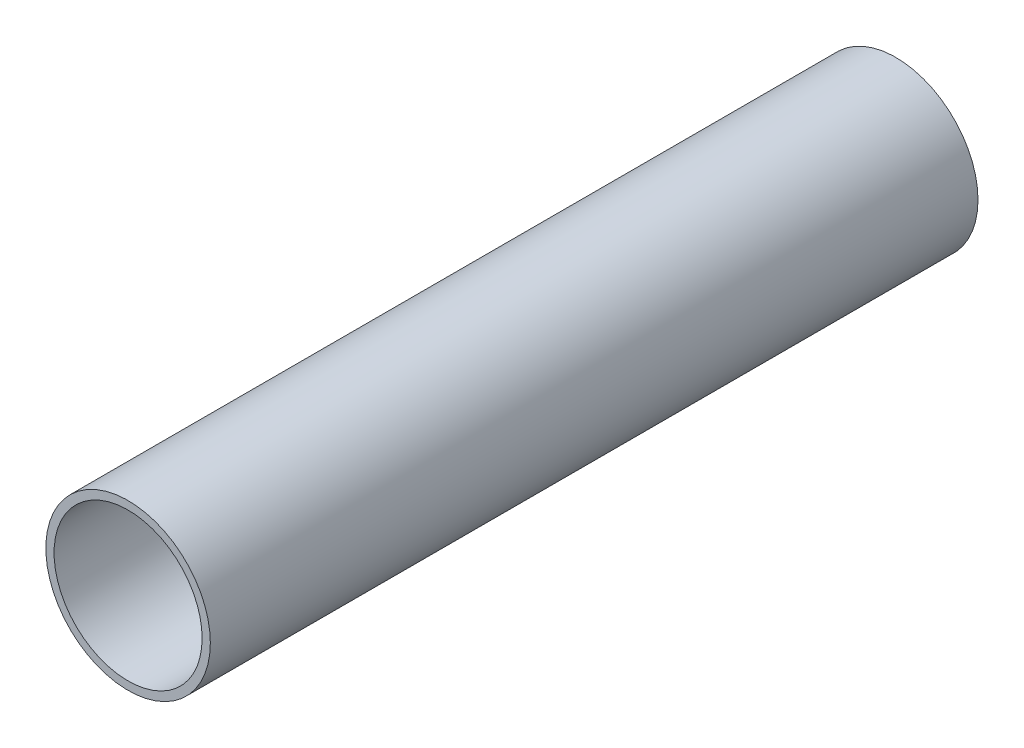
SolidWorks part; units mm, degrees
ref_plane "Plan de face" through (0, 0, 0) normal (0, 0, 1) x (1, 0, 0)
ref_plane "Plan de dessus" through (0, 0, 0) normal (0, 1, 0) x (1, 0, 0)
ref_plane "Plan de droite" through (0, 0, 0) normal (1, 0, 0) x (0, 0, -1)
sketch "Esquisse1" plane through (0, 0, 0) normal (0, 0, 1) x (1, 0, 0)
  circle A0 centre (0, 0) radius 13.5
  circle A1 centre (0, 0) radius 15
  dimension "D1" = 27
  dimension "D2" = 30
extrude "Extrusion1" add sketch "Esquisse1" along normal blind 140
